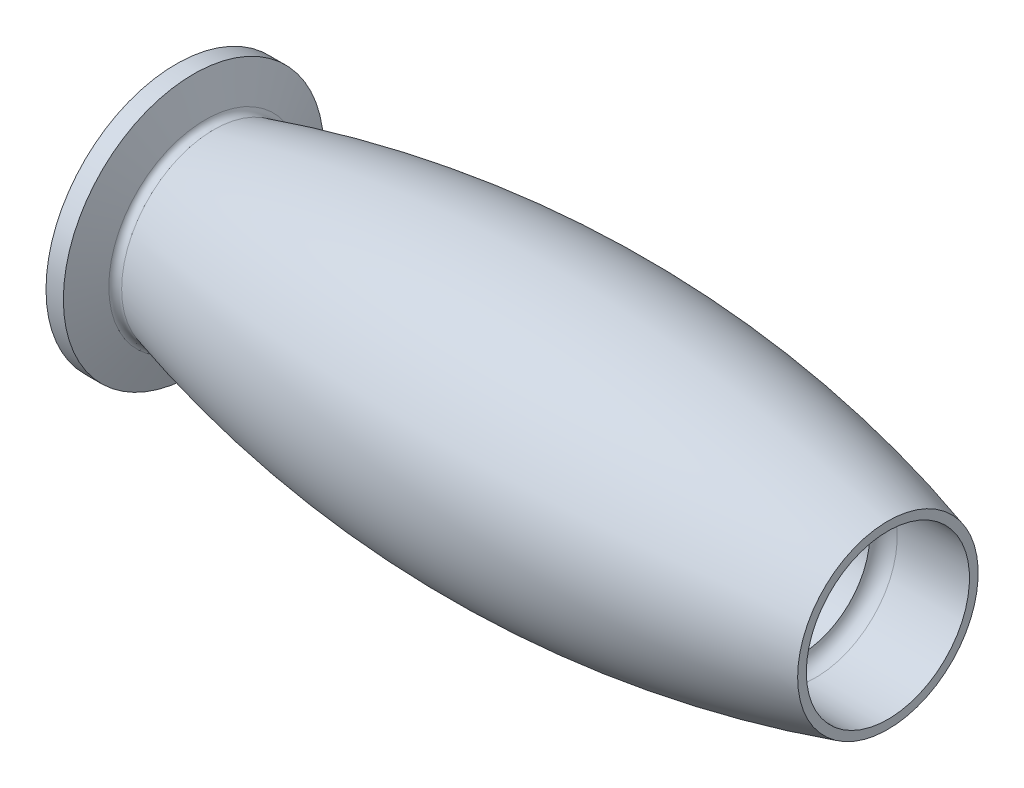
SolidWorks part; units mm, degrees
ref_plane "Plan1" through (0, 0, 0) normal (0, 0, 1) x (1, 0, 0)
ref_plane "Plan2" through (0, 0, 0) normal (0, 1, 0) x (1, 0, 0)
ref_plane "Plan3" through (0, 0, 0) normal (1, 0, 0) x (0, 0, -1)
sketch "Esquisse1" plane through (0, 0, 0) normal (0, 0, 1) x (1, 0, 0)
  line L0 (7, -11.75) -> (13, -11.75)
  line L1 (4, -12) -> (6.5, -18.75)
  line L2 (6.5, -18.75) -> (9, -18.75)
  line L3 (9, -18.75) -> (10.6886, -13.8951)
  line L4 (15, -7) -> (15, -10)
  line L5 (15, -10) -> (96.4, -10)
  line L6 (109, -13) -> (109, -11.75)
  line L7 (13, -7) -> (15, -7)
  line L8 (-20, 0) -> (140, 0) construction
  line L9 (96.4, -10) -> (96.4, -11.75)
  line L10 (96.4, -11.75) -> (109, -11.75)
  line L11 (4, -12) -> (7, -12)
  line L12 (7, -12) -> (7, -11.75)
  line L13 (13, -11.75) -> (13, -7)
  arc A0 (11.908, -13.2622) -> (109, -13) centre (60, 155) ccw
  arc A1 (11.908, -13.2622) -> (10.6886, -13.8951) centre (11.6331, -14.2237) ccw
  point P18 (11, -13)
  dimension "D13" = 1
  dimension "D1" = 12
  dimension "D2" = 18.75
  dimension "D3" = 7
  dimension "D4" = 2.5
  dimension "D5" = 2.5
  dimension "D6" = 2
  dimension "D7" = 13
  dimension "D8" = 13
  dimension "D9" = 10
  dimension "D10" = 11.75
  dimension "D11" = 3
  dimension "D12" = 12.6
  dimension "D14" = 105
  dimension "D15" = 94
  dimension "D16" = 2
  dimension "D17" = 11.75
revolve "Base-Révolution" add sketch "Esquisse1" angle 360 about L8
fillet "Congé1" radius 2.25 2 edges at (13, 0, 11.75) (96.4, 0, 11.75)
